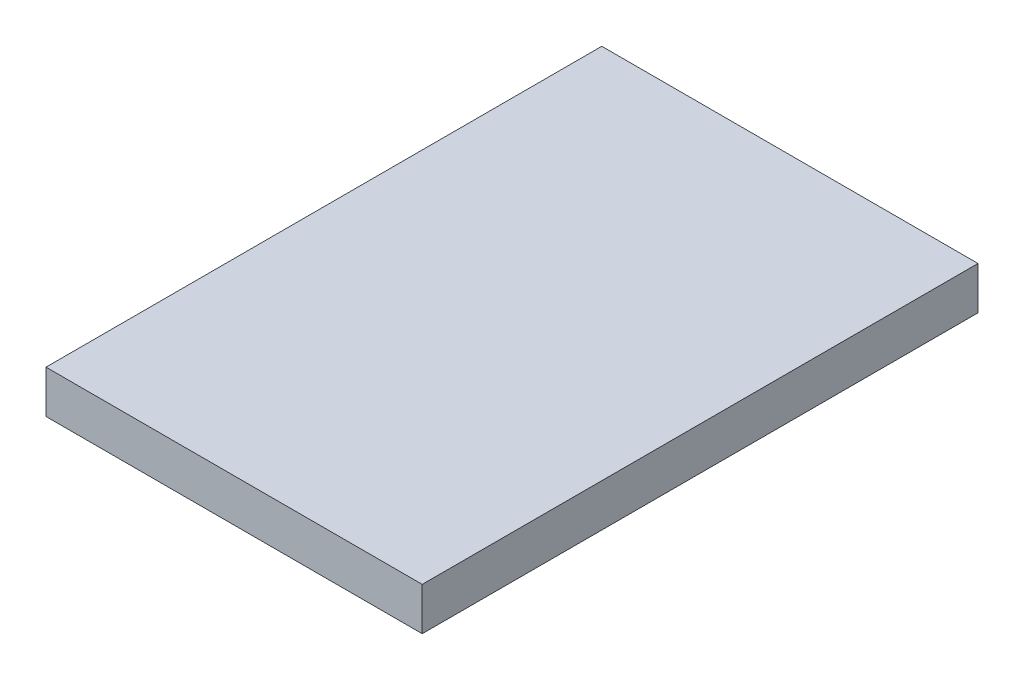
SolidWorks part; units mm, degrees
ref_plane "Front Plane" through (0, 0, 0) normal (0, 0, 1) x (1, 0, 0)
ref_plane "Top Plane" through (0, 0, 0) normal (0, 1, 0) x (1, 0, 0)
ref_plane "Right Plane" through (0, 0, 0) normal (1, 0, 0) x (0, 0, -1)
sketch "Sketch1" plane through (0, 0, 0) normal (0, 0, 1) x (1, 0, 0)
  line L1 (-44, 10) -> (44, 10)
  line L2 (-44, 10) -> (-44, 0)
  line L3 (-44, 0) -> (44, 0)
  line L4 (44, 10) -> (44, 0)
  dimension "D1" = 10
  dimension "D2" = 88
extrude "Extrude1" add sketch "Sketch1" along normal blind 130
